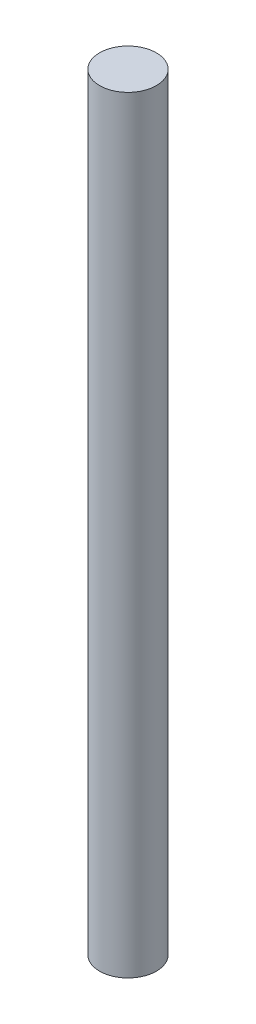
SolidWorks part; units mm, degrees
ref_plane "Ebene vorne" through (0, 0, 0) normal (0, 0, 1) x (1, 0, 0)
ref_plane "Ebene oben" through (0, 0, 0) normal (0, 1, 0) x (1, 0, 0)
ref_plane "Ebene rechts" through (0, 0, 0) normal (1, 0, 0) x (0, 0, -1)
sketch "Skizze1" plane through (0, 0, 0) normal (0, 1, 0) x (1, 0, 0)
  circle A0 centre (0, 0) radius 4
extrude "Aufsatz-Linear austragen1" add sketch "Skizze1" along normal blind 108
